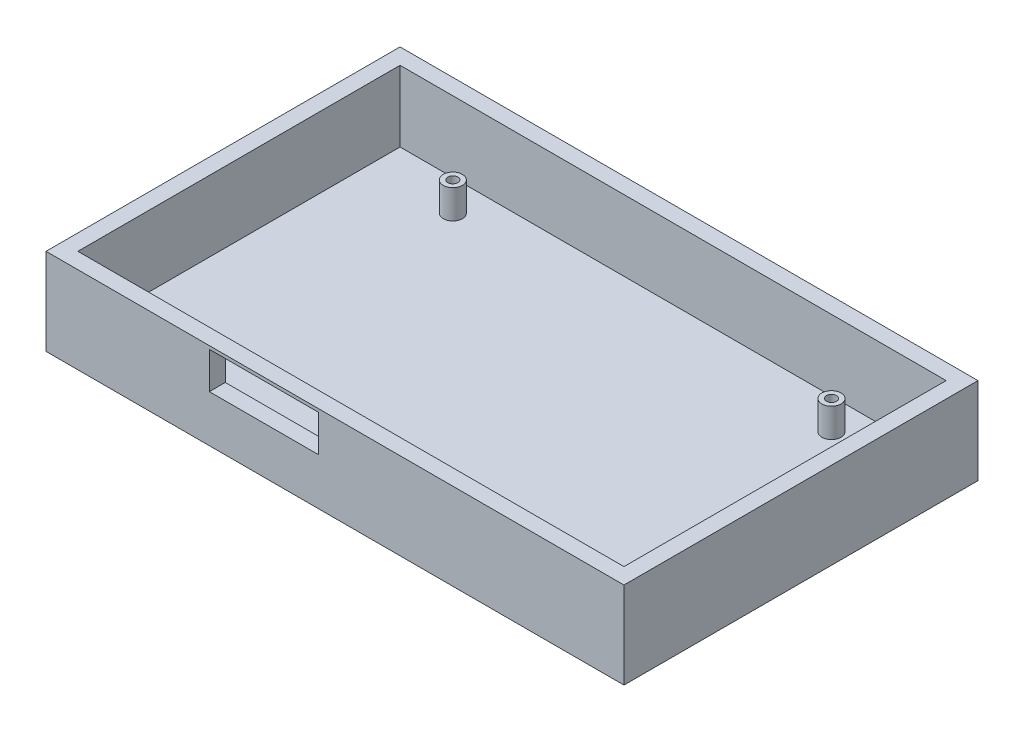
SolidWorks part; units mm, degrees
ref_plane "Front Plane" through (0, 0, 0) normal (0, 0, 1) x (1, 0, 0)
ref_plane "Top Plane" through (0, 0, 0) normal (0, 1, 0) x (1, 0, 0)
ref_plane "Right Plane" through (0, 0, 0) normal (1, 0, 0) x (0, 0, -1)
sketch "Sketch1" plane through (0, 0, 0) normal (0, 1, 0) x (1, 0, 0)
  line L1 (-48.8249, 28.2427) -> (78.1751, 28.2427)
  line L2 (-48.8249, 28.2427) -> (-48.8249, -49.5542)
  line L3 (-48.8249, -49.5542) -> (78.1751, -49.5542)
  line L4 (78.1751, 28.2427) -> (78.1751, -49.5542)
  dimension "D1" = 127
  dimension "D2" = 77.7969
extrude "Boss-Extrude1" add sketch "Sketch1" along normal blind 19.05
shell "Shell1" thickness 3.5
sketch "Sketch2" plane through (0, 3.5, 0) normal (0, 1, 0) x (1, 0, 0)
  line L0 (-45.3249, 24.7427) -> (-45.3249, -46.0542) construction
  line L1 (74.6751, -46.0542) -> (74.6751, 24.7427) construction
  line L2 (74.6751, 24.7427) -> (-45.3249, 24.7427) construction
  line L3 (-45.3249, -46.0542) -> (74.6751, -46.0542) construction
  circle A0 centre (56.2752, -39.2576) radius 2.1
  circle A1 centre (-26.925, -39.2576) radius 2.1
  circle A2 centre (-26.925, 17.9427) radius 2.1
  circle A3 centre (56.2752, 17.9427) radius 2.1
  dimension "D1" = 83.2002
  dimension "D2" = 57.2003
  dimension "D3" = 83.2002
  dimension "D4" = 57.2003
  dimension "D5" = 18.3999
  dimension "D6" = 18.3999
  dimension "D7" = 6.8
  dimension "D8" = 6.7966
extrude "Boss-Extrude2" add sketch "Sketch2" along normal blind 6.35
sketch "Sketch4" plane through (0, 9.85, 0) normal (0, 1, 0) x (1, 0, 0)
  point P0 (56.2752, -39.2576)
  point P1 (-26.925, -39.2576)
  point P3 (-26.925, 17.9427)
  point P5 (56.2752, 17.9427)
  point P7 (0, 0)
  point P9 (0, 0)
  point P10 (0, 0)
  point P11 (0, 0)
  point P12 (0, 0)
  point P13 (0, 0)
hole_wizard "#44 (0.086) Diameter Hole1" positions "3DSketch1" profile "Sketch5" hole size "#44" standard "ANSI Inch"
sketch3d "3DSketch1"
  point P0 (56.2752, 9.85, 39.2576)
sketch "Sketch5" plane through (56.2752, 9.85, 39.2576) normal (1, 0, 0) x (0, 0, 1)
  line L0 (0, 0) -> (0, 4.4663)
  line L1 (0, 4.4663) -> (1.0922, 3.81)
  line L2 (1.0922, 3.81) -> (1.0922, 0)
  line L5 (1.0922, 0) -> (0, 0)
  line L10 (0, 4.4663) -> (-1.0922, 3.81) construction
  line L11 (0, -6.35) -> (0, 107.95) construction
  dimension "Hole Dia." = 2.1844
  dimension "Hole Depth" = 3.81
  dimension "Drill Angle" = 118
hole_wizard "#44 (0.086) Diameter Hole2" positions "3DSketch2" profile "Sketch6" hole size "#44" standard "ANSI Inch"
sketch3d "3DSketch2"
  point P0 (-26.925, 9.85, 39.2576)
sketch "Sketch6" plane through (-26.925, 9.85, 39.2576) normal (1, 0, 0) x (0, 0, 1)
  line L0 (0, 0) -> (0, 4.4663)
  line L1 (0, 4.4663) -> (1.0922, 3.81)
  line L2 (1.0922, 3.81) -> (1.0922, 0)
  line L5 (1.0922, 0) -> (0, 0)
  line L10 (0, 4.4663) -> (-1.0922, 3.81) construction
  line L11 (0, -6.35) -> (0, 107.95) construction
  dimension "Hole Dia." = 2.1844
  dimension "Hole Depth" = 3.81
  dimension "Drill Angle" = 118
hole_wizard "#44 (0.086) Diameter Hole3" positions "3DSketch3" profile "Sketch7" hole size "#44" standard "ANSI Inch"
sketch3d "3DSketch3"
  point P0 (-26.925, 9.85, -17.9427)
sketch "Sketch7" plane through (-26.925, 9.85, -17.9427) normal (1, 0, 0) x (0, 0, 1)
  line L0 (0, 0) -> (0, 4.4663)
  line L1 (0, 4.4663) -> (1.0922, 3.81)
  line L2 (1.0922, 3.81) -> (1.0922, 0)
  line L5 (1.0922, 0) -> (0, 0)
  line L10 (0, 4.4663) -> (-1.0922, 3.81) construction
  line L11 (0, -6.35) -> (0, 107.95) construction
  dimension "Hole Dia." = 2.1844
  dimension "Hole Depth" = 3.81
  dimension "Drill Angle" = 118
hole_wizard "#44 (0.086) Diameter Hole4" positions "3DSketch4" profile "Sketch8" hole size "#44" standard "ANSI Inch"
sketch3d "3DSketch4"
  point P0 (56.2752, 9.85, -17.9427)
sketch "Sketch8" plane through (56.2752, 9.85, -17.9427) normal (1, 0, 0) x (0, 0, 1)
  line L0 (0, 0) -> (0, 4.4663)
  line L1 (0, 4.4663) -> (1.0922, 3.81)
  line L2 (1.0922, 3.81) -> (1.0922, 0)
  line L5 (1.0922, 0) -> (0, 0)
  line L10 (0, 4.4663) -> (-1.0922, 3.81) construction
  line L11 (0, -6.35) -> (0, 107.95) construction
  dimension "Hole Dia." = 2.1844
  dimension "Hole Depth" = 3.81
  dimension "Drill Angle" = 118
sketch "Sketch9" plane through (0, 0, -28.2427) normal (0, 0, -1) x (-1, 0, 0)
  text T0 "PIXIE" font "Bell MT" height in points 48
extrude "Cut-Extrude1" cut sketch "Sketch9" against normal blind 2.5
sketch "Sketch10" plane through (0, 0, 49.5542) normal (0, 0, 1) x (1, 0, 0)
  line L0 (-45.3249, 19.05) -> (-45.3249, 3.5) construction
  line L1 (-12.9281, 10.2887) -> (11.0719, 10.2887)
  line L2 (-12.9281, 10.2887) -> (-12.9281, 18.3509)
  line L3 (-12.9281, 18.3509) -> (11.0719, 18.3509)
  line L4 (11.0719, 10.2887) -> (11.0719, 18.3509)
  dimension "D1" = 24
  dimension "D3" = 32.3968
extrude "Cut-Extrude2" cut sketch "Sketch10" against normal up to next
